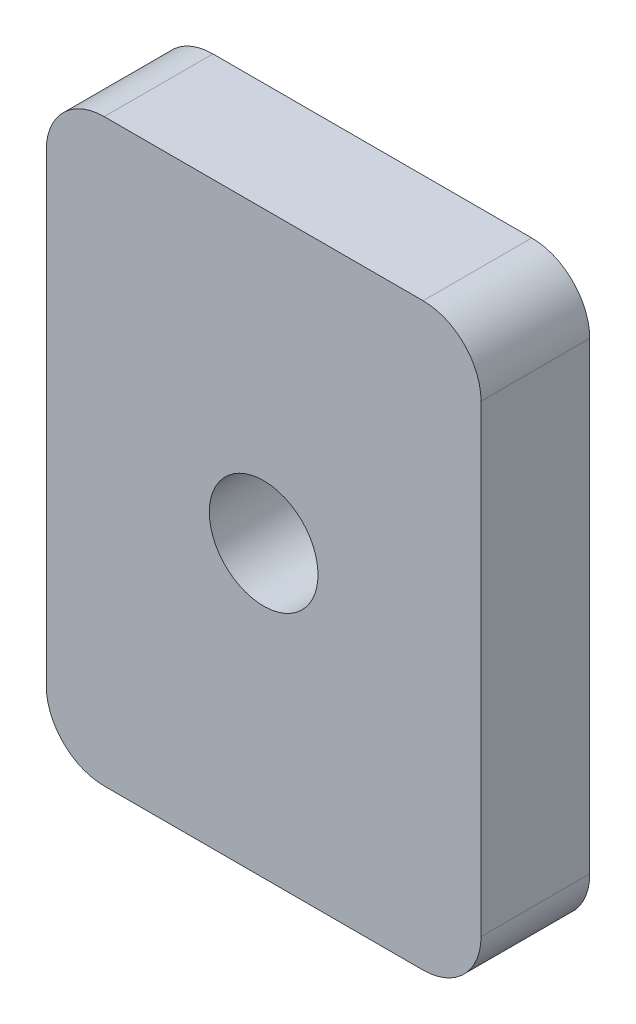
SolidWorks part; units mm, degrees
ref_plane "Front Plane" through (0, 0, 0) normal (0, 0, 1) x (1, 0, 0)
ref_plane "Top Plane" through (0, 0, 0) normal (0, 1, 0) x (1, 0, 0)
ref_plane "Right Plane" through (0, 0, 0) normal (1, 0, 0) x (0, 0, -1)
sketch "Sketch1" plane through (0, 0, 0) normal (0, 0, 1) x (1, 0, 0)
  line L1 (0, 0) -> (19.05, 0)
  line L2 (0, 0) -> (0, 25.4)
  line L3 (0, 25.4) -> (19.05, 25.4)
  line L4 (19.05, 0) -> (19.05, 25.4)
  circle A0 centre (9.525, 12.7) radius 2.3813
  point P8 (14.1309, 25.4)
  dimension "D3" = 9.525
  dimension "D1" = 19.05
  dimension "D2" = 25.4
  dimension "D4" = 12.7
extrude "Boss-Extrude1" add sketch "Sketch1" along normal blind 4.7625
fillet "Fillet1" radius 2.54 4 edges at (0, 0, 2.3813) (19.05, 0, 2.3813) (0, 25.4, 2.3813) (19.05, 25.4, 2.3813)
